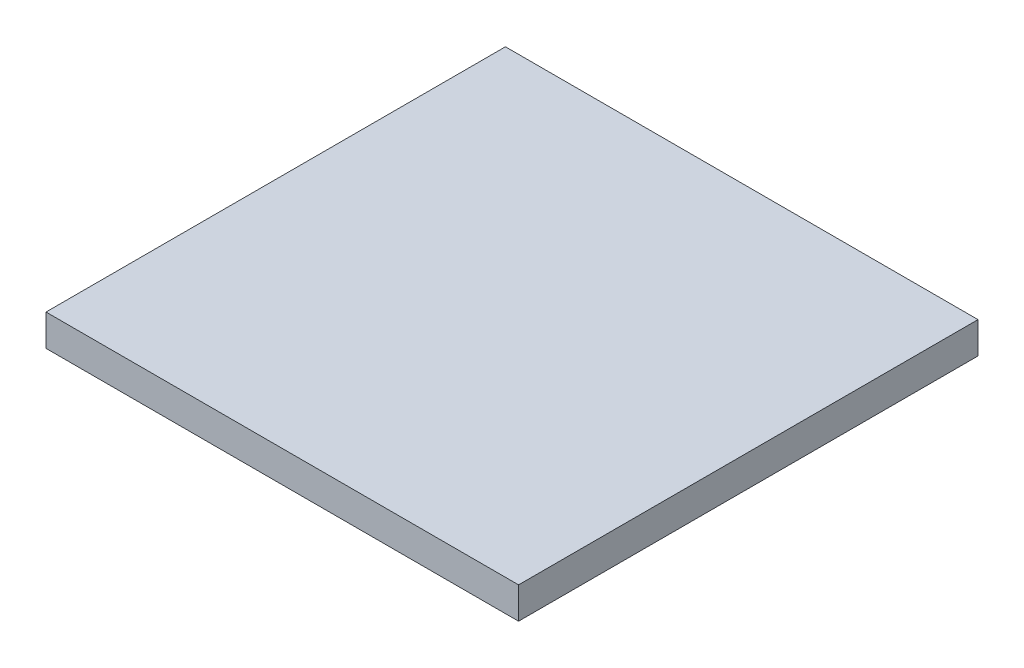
SolidWorks part; units mm, degrees
ref_plane "Plan de face" through (0, 0, 0) normal (0, 0, 1) x (1, 0, 0)
ref_plane "Plan de dessus" through (0, 0, 0) normal (0, 1, 0) x (1, 0, 0)
ref_plane "Plan de droite" through (0, 0, 0) normal (1, 0, 0) x (0, 0, -1)
sketch "Esquisse1" plane through (0, 0, 0) normal (0, 1, 0) x (1, 0, 0)
  line L1 (0, 0) -> (180, 0)
  line L2 (0, 0) -> (0, 175)
  line L3 (0, 175) -> (180, 175)
  line L4 (180, 0) -> (180, 175)
  dimension "D1" = 180
  dimension "D2" = 175
extrude "Boss.-Extru.1" add sketch "Esquisse1" along normal blind 12
